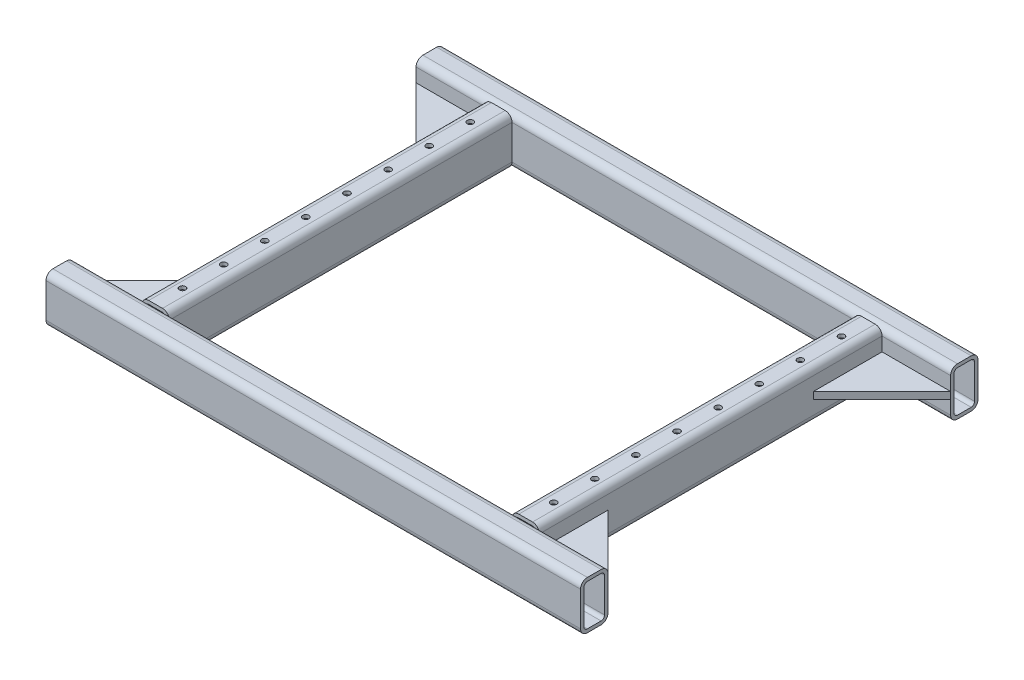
SolidWorks part; units mm, degrees
other "Element opisowy2"
other "Element opisowy3"
other "Element opisowy4"
other "Element opisowy7"
other "Element opisowy8"
other "Element opisowy9"
other "Element opisowy10"
other "Element opisowy11"
other "Element opisowy12"
other "Element opisowy13"
other "Element opisowy14"
other "Element opisowy15"
other "Element opisowy16"
other "Element opisowy17"
other "Element opisowy18"
other "Element opisowy19"
other "Folder spoin"
other "Ścieg spoiny2"
other "Ścieg spoiny3"
other "Ścieg spoiny4"
other "Ścieg spoiny7"
other "Ścieg spoiny8"
other "Ścieg spoiny9"
other "Ścieg spoiny10"
other "Ścieg spoiny11"
other "Ścieg spoiny12"
other "Ścieg spoiny13"
other "Ścieg spoiny14"
other "Ścieg spoiny15"
other "Ścieg spoiny16"
other "Ścieg spoiny17"
other "Ścieg spoiny18"
other "Ścieg spoiny19"
ref_plane "Płaszczyzna przednia" through (0, 0, 0) normal (0, 0, 1) x (1, 0, 0)
ref_plane "Płaszczyzna górna" through (0, 0, 0) normal (0, 1, 0) x (1, 0, 0)
ref_plane "Płaszczyzna prawa" through (0, 0, 0) normal (1, 0, 0) x (0, 0, -1)
sketch "Szkic1" plane through (0, 0, 0) normal (0, 1, 0) x (1, 0, 0)
  line L0 (0, -270) -> (0, 270) construction
  line L1 (-390, -270) -> (390, -270)
  line L2 (-390, -270) -> (-390, 270) construction
  line L3 (-390, 270) -> (390, 270)
  line L4 (390, -270) -> (390, 270) construction
  line L5 (-390, -270) -> (390, 270) construction
  line L6 (-390, 270) -> (390, -270) construction
  line L7 (-270, 270) -> (-270, -270)
  line L8 (270, 270) -> (270, -270)
  point P0 (0, 0)
  dimension "D1" = 540
  dimension "D2" = 780
  dimension "D3" = 540
other "Człon konstrukcyjny1"
ref_plane "Płaszczyzna1" through (-390, 0, -270) normal (1, 0, 0) x (0, 0, -1)
sketch "Sketch11" plane through (-390, 0, -270) normal (1, 0, 0) x (0, 0, -1)
  line L0 (-10, -30) -> (10, -30)
  line L1 (-15, -25) -> (-15, 25)
  line L2 (10, 30) -> (-10, 30)
  line L3 (15, 25) -> (15, -25)
  line L4 (-10, -35) -> (10, -35)
  line L5 (-20, -25) -> (-20, 25)
  line L6 (10, 35) -> (-10, 35)
  line L7 (20, 25) -> (20, -25)
  arc A0 (20, 25) -> (10, 35) centre (10, 25) ccw
  arc A1 (10, -35) -> (20, -25) centre (10, -25) ccw
  arc A2 (-20, -25) -> (-10, -35) centre (-10, -25) ccw
  arc A3 (-10, 35) -> (-20, 25) centre (-10, 25) ccw
  arc A4 (-10, 30) -> (-15, 25) centre (-10, 25) ccw
  arc A5 (15, 25) -> (10, 30) centre (10, 25) ccw
  arc A6 (10, -30) -> (15, -25) centre (10, -25) ccw
  arc A7 (-15, -25) -> (-10, -30) centre (-10, -25) ccw
  point P0 (0, 35)
  point P1 (20, 0)
  point P2 (0, -35)
  point P3 (-20, 0)
  point P4 (-20, 35)
  point P5 (20, 35)
  point P6 (20, -35)
  point P7 (-20, -35)
  point P8 (0, 0)
  point P33 (0, 0)
  point P35 (0, 0)
  dimension "D1" = 10
  dimension "Thickness" = 5
  dimension "V_leg" = 70
  dimension "H_leg" = 40
hole_wizard "Pogłębienie walcowe pod M8 Wkręt do części metalowych z łbem sześciokątnym1" positions "Szkic3" profile "Szkic2" counterbore size "M8" standard "Ansi Metric"
sketch "Szkic3" plane through (0, -35, 0) normal (0, -1, 0) x (-1, 0, 0)
  line L0 (-390, -250) -> (390, -250) construction
  line L1 (291.5903, -210) -> (250, -210) construction
  line L2 (250, -250) -> (250, 250) construction
  point P0 (270.7951, -210)
  point P47 (270.7951, -210)
  dimension "D1" = 40
sketch "Szkic2" plane through (-270.7951, -35, 210) normal (1, 0, 0) x (0, 0, -1)
  line L0 (0, 0) -> (0, 70)
  line L1 (0, 70) -> (4.5, 70)
  line L3 (4.5, 70) -> (4.5, 6)
  line L4 (4.5, 6) -> (8.63, 6)
  line L5 (8.63, 6) -> (8.63, 0)
  line L7 (8.63, 0) -> (0, 0)
  line L11 (0, -6.35) -> (0, 107.95) construction
  dimension "Średnica otworu na wylot" = 9
  dimension "Głębokość otworu na wylot" = 70
  dimension "Średnica pogłębienia walcowego" = 17.26
  dimension "Głębokość pogłębienia walcowego" = 6
pattern_linear "Szyk liniowy1" count 8 spacing 60 along (0, 0, -1) of "Pogłębienie walcowe pod M8 Wkręt do części metalowych z łbem sześciokątnym1"
other "Wzmocnienie1" parameters "D1"=10, "D2"=10, "D3"=0, "D4"=0, "D10"=5, "D11"=100, "D12"=100, "D13"=15, "D14"=45, "D15"=15
sketch "Szkic5" plane through (-290, 0, -250) normal (0, -1, 0) x (-1, 0, 0)
  line L0 (0, 0) -> (100, 0)
  line L1 (0, 0) -> (0, -100)
  line L2 (100, 0) -> (0, -100)
mirror "Rozstaw prowadnic" about plane through (0, 0, 0) normal (1, 0, 0) of "Szyk liniowy1", "Pogłębienie walcowe pod M8 Wkręt do części metalowych z łbem sześciokątnym1"
mirror "Wzmocnienie 1" about plane through (0, 0, 0) normal (1, 0, 0) of "Wzmocnienie1"
mirror "Wzmocnienie 2" about plane through (0, 0, 0) normal (0, 0, 1) of "Wzmocnienie1", "Wzmocnienie 1"
